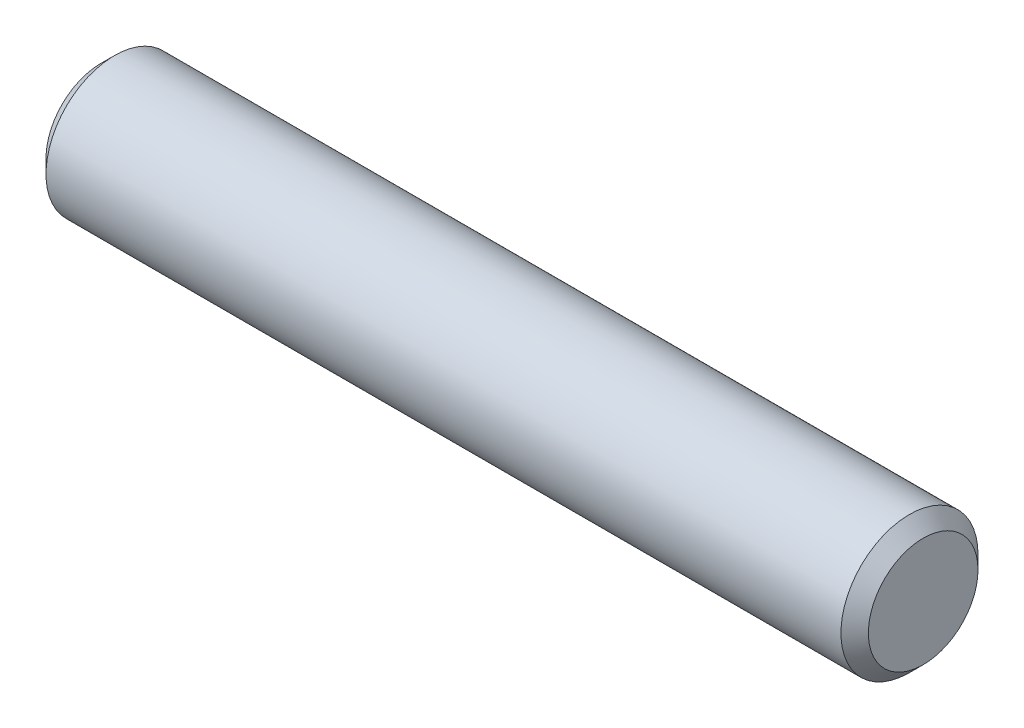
SolidWorks part; units mm, degrees
ref_plane "Front" through (0, 0, 0) normal (0, 0, 1) x (1, 0, 0)
ref_plane "Top" through (0, 0, 0) normal (0, 1, 0) x (1, 0, 0)
ref_plane "Right" through (0, 0, 0) normal (1, 0, 0) x (0, 0, -1)
sketch "Sketch1" plane through (0, 0, 0) normal (0, 0, 1) x (1, 0, 0)
  line L0 (-4.7625, 0) -> (4.7625, 0) construction
  line L1 (4.7625, 0.7937) -> (4.7625, -0.7937) construction
  line L2 (-4.7625, 0.7937) -> (-4.7625, -0.7937) construction
  dimension "Length" = 9.525
  dimension "Diameter" = 1.5875
sketch "Sketch2" plane through (0, 0, 0) normal (1, 0, 0) x (0, 0, -1)
  circle A0 centre (0, 0) radius 0.7937
extrude "Extrude1" add sketch "Sketch2" against normal up to vertex (4.7625 mm away) and the other way up to vertex (4.7625 mm away)
chamfer "Chamfer1" distance 0.1588 angle 45 2 edges at (4.7625, 0, -0.7937) (-4.7625, 0, -0.7937)
equation "\"D1@Chamfer1\" = \"Diameter@Sketch1\"*.1"
